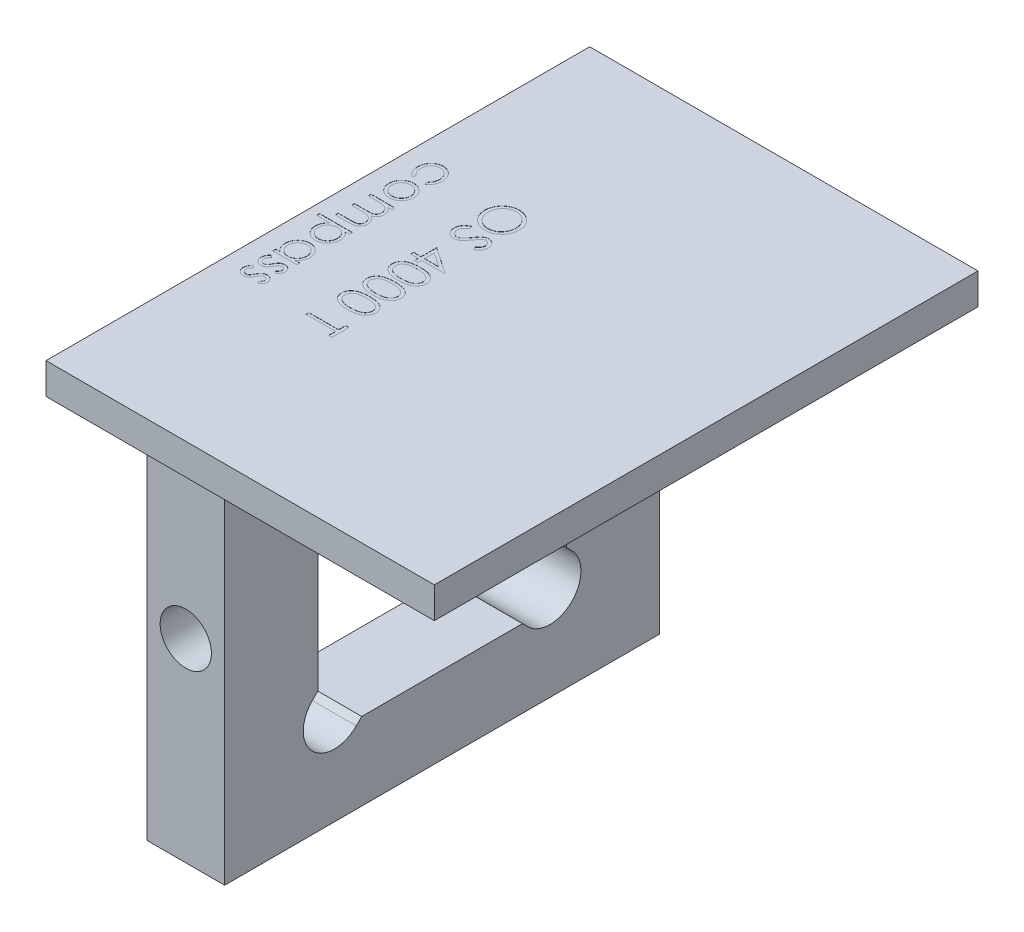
SolidWorks part; units mm, degrees
ref_plane "Plan de face" through (0, 0, 0) normal (0, 0, 1) x (1, 0, 0)
ref_plane "Plan de dessus" through (0, 0, 0) normal (0, 1, 0) x (1, 0, 0)
ref_plane "Plan de droite" through (0, 0, 0) normal (1, 0, 0) x (0, 0, -1)
sketch "Esquisse1" plane through (0, 0, 0) normal (0, 0, 1) x (1, 0, 0)
  line L1 (0, 0) -> (25, 0)
  line L2 (0, 0) -> (0, 2)
  line L3 (0, 2) -> (25, 2)
  line L4 (25, 0) -> (25, 2)
  dimension "D1" = 25
  dimension "D2" = 2
extrude "Boss.-Extru.1" add sketch "Esquisse1" along normal mid plane 35
sketch "Esquisse4" plane through (0, 0, 0) normal (-1, 0, 0) x (0, 0, 1)
  line L0 (17.5, 0) -> (-17.5, 0) construction
  line L1 (-8, -4) -> (8, -4) construction
  line L2 (-8, -4) -> (-8, -20) construction
  line L3 (-8, -20) -> (8, -20) construction
  line L4 (8, -4) -> (8, -20) construction
  line L6 (-14, 0) -> (14, 0)
  line L7 (-14, 0) -> (-14, -25)
  line L8 (-14, -25) -> (14, -25)
  line L9 (14, 0) -> (14, -25)
  line L10 (-8, -4) -> (8, -4)
  line L11 (-8, -4) -> (-8, -20)
  line L12 (-8, -20) -> (8, -20)
  line L13 (8, -4) -> (8, -20)
  dimension "D1" = 16
  dimension "D2" = 8
  dimension "D3" = 4
  dimension "D4" = 6
  dimension "D5" = 6
  dimension "D6" = 5
extrude "Boss.-Extru.3" add sketch "Esquisse4" against normal blind 5 from offset 3
sketch "Esquisse7" plane through (0, 2, 0) normal (0, 1, 0) x (1, 0, 0)
  line L0 (5.7902, 6.288) -> (5.7902, -21.9313) construction
  text T0 "OS 4000 T  compass" font "Century Gothic" height in points 8
extrude "Enlèv. mat.-Extru.2" cut sketch "Esquisse7" against normal blind 0.01
hole_wizard "Trou taraudé M41" positions "Esquisse9" profile "Esquisse8" tap size "M4" standard "ISO"
sketch "Esquisse9" plane through (0, 0, 14) normal (0, 0, 1) x (1, 0, 0)
  line L0 (8, -25) -> (3, -25) construction
  line L1 (3, -25) -> (3, 0) construction
  point P0 (5.5, -12.5)
  dimension "D1" = 12.5
  dimension "D2" = 2.5
sketch "Esquisse8" plane through (5.5, -12.5, 14) normal (1, 0, 0) x (0, -1, 0)
  line L0 (0, 0) -> (0, 31.5)
  line L1 (0, 31.5) -> (1.65, 31.5)
  line L2 (1.65, 31.5) -> (1.65, 0)
  line L5 (1.65, 0) -> (0, 0)
  line L11 (0, -6.35) -> (0, 107.95) construction
  dimension "Diamètre du trou pour taraudage jusqu'au prochain" = 3.3
  dimension "Profondeur du trou pour taraudage jusqu'au prochain" = 31.5
sketch "Esquisse10" plane through (3, 0, 0) normal (-1, 0, 0) x (0, 0, 1)
  line L0 (8, -20) -> (-8, -4) construction
  line L1 (-5.5251, -3.6464) -> (-3.4236, -5.748)
  line L2 (-8.3536, -6.4749) -> (-6.5745, -8.2539)
  line L3 (-6.5745, -8.2539) -> (-3.4236, -5.748)
  line L4 (-8, -20) -> (8, -4) construction
  line L5 (8, -20) -> (8, -4) construction
  line L6 (8.3526, -6.4739) -> (6.251, -8.5754)
  line L7 (3.7451, -5.4245) -> (6.251, -8.5754)
  line L8 (5.5241, -3.6454) -> (3.7451, -5.4245)
  line L9 (5.5251, -20.3516) -> (3.4236, -18.25)
  line L10 (6.5745, -15.7441) -> (3.4236, -18.25)
  line L11 (8.3536, -17.5231) -> (6.5745, -15.7441)
  line L12 (-8.3526, -17.5241) -> (-6.251, -15.4226)
  line L13 (-3.7451, -18.5735) -> (-6.251, -15.4226)
  line L14 (-5.5241, -20.3526) -> (-3.7451, -18.5735)
  arc A0 (-5.5251, -3.6464) -> (-8.3536, -6.4749) centre (-6.9393, -5.0607) ccw
  arc A1 (8.3526, -6.4739) -> (5.5241, -3.6454) centre (6.9383, -5.0597) ccw
  arc A2 (5.5251, -20.3516) -> (8.3536, -17.5231) centre (6.9393, -18.9373) ccw
  arc A3 (-8.3526, -17.5241) -> (-5.5241, -20.3526) centre (-6.9383, -18.9383) ccw
  point P14 (0, -12)
  dimension "D1" = 4
  dimension "D2" = 1.5
  dimension "D3" = 4
extrude "Enlèv. mat.-Extru.3" cut sketch "Esquisse10" against normal blind 10
